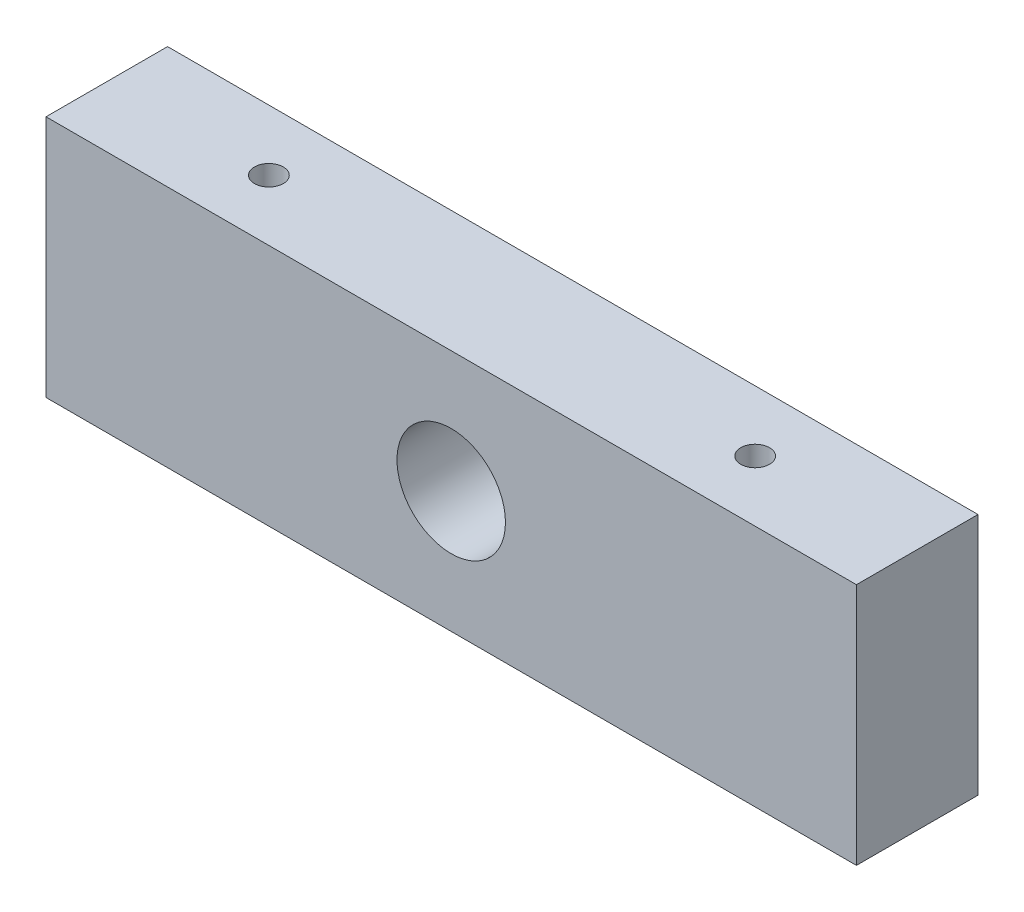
SolidWorks part; units mm, degrees
ref_plane "Front Plane" through (0, 0, 0) normal (0, 0, 1) x (1, 0, 0)
ref_plane "Top Plane" through (0, 0, 0) normal (0, 1, 0) x (1, 0, 0)
ref_plane "Right Plane" through (0, 0, 0) normal (1, 0, 0) x (0, 0, -1)
sketch "Sketch1" plane through (0, 0, 0) normal (0, 1, 0) x (1, 0, 0)
  line L1 (0, 0) -> (63.5, 0)
  line L2 (0, 0) -> (0, 9.525)
  line L3 (0, 9.525) -> (63.5, 9.525)
  line L4 (63.5, 0) -> (63.5, 9.525)
  dimension "D1" = 9.525
  dimension "D2" = 63.5
extrude "Boss-Extrude1" add sketch "Sketch1" along normal blind 19.05
hole_wizard "M10x1.5 Tapped Hole1" positions "Sketch2" profile "Sketch3" tap size "M10x1.5" standard "ANSI Metric"
sketch "Sketch2" plane through (0, 0, 0) normal (0, 0, 1) x (1, 0, 0)
  line L0 (0, 9.525) -> (31.75, 9.525) construction
  line L1 (0, 19.05) -> (0, 0) construction
  line L6 (31.75, 9.525) -> (63.5, 9.525) construction
  line L7 (63.5, 19.05) -> (63.5, 0) construction
  point P2 (31.75, 9.525)
sketch "Sketch3" plane through (31.75, 9.525, 0) normal (1, 0, 0) x (0, -1, 0)
  line L0 (0, 0) -> (0, 9.525)
  line L1 (0, 9.525) -> (4.25, 9.525)
  line L2 (4.25, 9.525) -> (4.25, 0)
  line L5 (4.25, 0) -> (0, 0)
  line L11 (0, -6.35) -> (0, 107.95) construction
  dimension "Thru Tap Drill Dia." = 8.5
  dimension "Thru Tap Drill Depth" = 9.525
hole_wizard "#4-40 Tapped Hole1" positions "Sketch4" profile "Sketch5" tap size "#4-40" standard "ANSI Inch"
sketch "Sketch4" plane through (0, 19.05, 0) normal (0, 1, 0) x (1, 0, 0)
  line L0 (0, 4.7625) -> (12.7, 4.7625) construction
  line L1 (0, 9.525) -> (0, 0) construction
  line L5 (50.8, 4.7625) -> (63.5, 4.7625) construction
  line L6 (63.5, 0) -> (63.5, 9.525) construction
  point P2 (12.7, 4.7625)
  point P8 (50.8, 4.7625)
  dimension "D2" = 38.1
sketch "Sketch5" plane through (50.8, 19.05, -4.7625) normal (1, 0, 0) x (0, 0, 1)
  line L0 (0, 0) -> (0, 19.05)
  line L1 (0, 19.05) -> (1.1303, 19.05)
  line L2 (1.1303, 19.05) -> (1.1303, 0)
  line L5 (1.1303, 0) -> (0, 0)
  line L11 (0, -6.35) -> (0, 107.95) construction
  dimension "Thru Tap Drill Dia." = 2.2606
  dimension "Thru Tap Drill Depth" = 19.05
